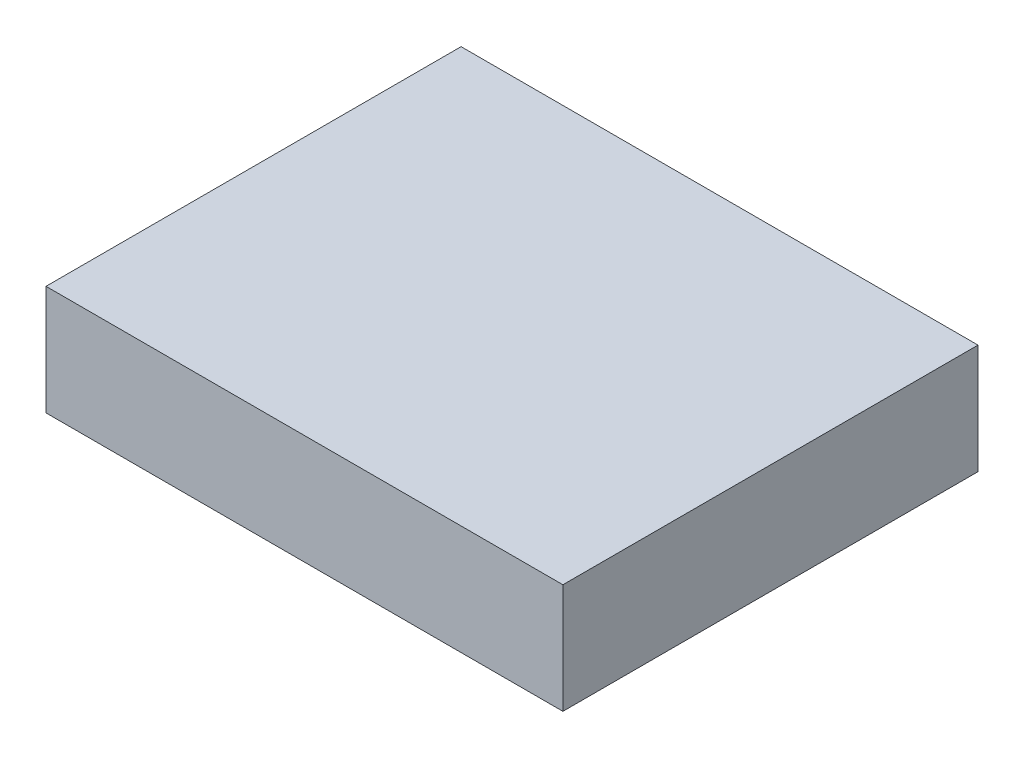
SolidWorks part; units mm, degrees
ref_plane "Front Plane" through (0, 0, 0) normal (0, 0, 1) x (1, 0, 0)
ref_plane "Top Plane" through (0, 0, 0) normal (0, 1, 0) x (1, 0, 0)
ref_plane "Right Plane" through (0, 0, 0) normal (1, 0, 0) x (0, 0, -1)
sketch "Sketch1" plane through (0, 0, 0) normal (0, 1, 0) x (1, 0, 0)
  line L1 (0, 0) -> (66, 0)
  line L2 (0, 0) -> (0, 53)
  line L3 (0, 53) -> (66, 53)
  line L4 (66, 0) -> (66, 53)
  dimension "D1" = 66
  dimension "D2" = 53
extrude "Boss-Extrude1" add sketch "Sketch1" along normal blind 14
